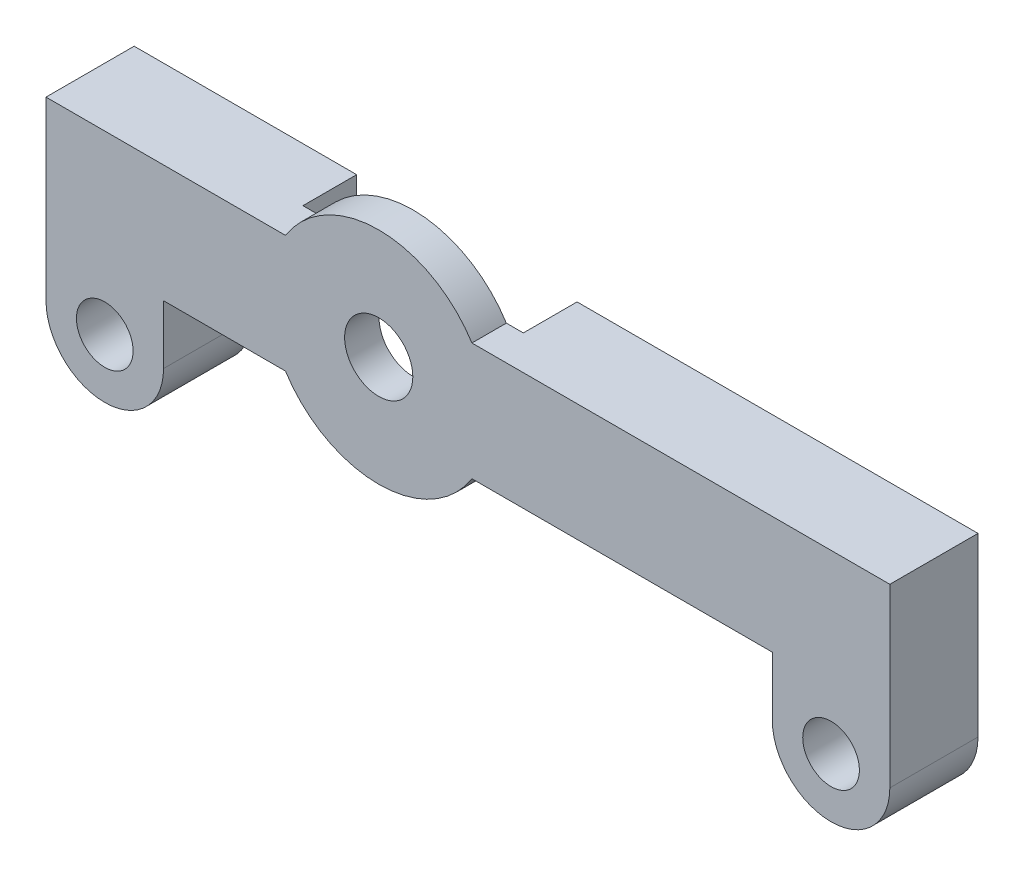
SolidWorks part; units mm, degrees
ref_plane "Front Plane" through (0, 0, 0) normal (0, 0, 1) x (1, 0, 0)
ref_plane "Top Plane" through (0, 0, 0) normal (0, 1, 0) x (1, 0, 0)
ref_plane "Right Plane" through (0, 0, 0) normal (1, 0, 0) x (0, 0, -1)
sketch "Sketch1" plane through (0, 0, 0) normal (0, 0, 1) x (1, 0, 0)
  line L0 (0, 0) -> (0, 5.6) construction
  line L1 (0, 0) -> (-17.3, 0) construction
  line L2 (0, 5.6) -> (-4.25, 5.6) construction
  line L3 (-14.5, 0) -> (-14.5, 2.8)
  line L4 (-14.5, 2.8) -> (14.5, 2.8)
  line L5 (-20.1, 0) -> (-20.1, 8.4)
  line L6 (-20.1, 8.4) -> (20.1, 8.4)
  line L7 (14.5, 0) -> (14.5, 2.8)
  line L8 (20.1, 0) -> (20.1, 8.4)
  circle A0 centre (-17.3, 0) radius 1.35
  circle A1 centre (-4.25, 5.6) radius 1.625
  arc A2 (-20.1, 0) -> (-14.5, 0) centre (-17.3, 0) ccw
  circle A3 centre (17.3, 0) radius 1.35
  arc A4 (20.1, 0) -> (14.5, 0) centre (17.3, 0) cw
  point P18 (0, 2.8)
  point P19 (0, 8.4)
  dimension "D4" = 2.7
  dimension "D5" = 2.8
  dimension "D6" = 2.8
  dimension "D7" = 3.25
  dimension "D1" = 17.3
  dimension "D2" = 5.6
  dimension "D3" = 4.25
extrude "Boss-Extrude1" add sketch "Sketch1" along normal blind 4.2
sketch "Sketch2" plane through (0, 0, 0) normal (0, 0, -1) x (-1, 0, 0)
  line L0 (4.25, 3.975) -> (4.25, 7.225) construction
  line L1 (14.5, 2.8) -> (-14.5, 2.8) construction
  line L2 (9.5, 2.8) -> (-1, 2.8)
  line L3 (9.5, 2.8) -> (9.5, 8.4)
  line L4 (9.5, 8.4) -> (-1, 8.4)
  line L5 (-1, 2.8) -> (-1, 8.4)
  line L6 (-20.1, 8.4) -> (20.1, 8.4) construction
  circle A0 centre (4.25, 5.6) radius 1.625 construction
  dimension "D1" = 5.25
extrude "Cut-Extrude1" cut sketch "Sketch2" against normal blind 2.56
sketch "Sketch3" plane through (0, 0, 4.2) normal (0, 0, 1) x (1, 0, 0)
  circle A0 centre (-4.25, 5.6) radius 5.25
  circle A1 centre (-4.25, 5.6) radius 1.625
  dimension "D1" = 10.5
extrude "Boss-Extrude3" add sketch "Sketch3" against normal up to surface (1.64 mm away)
